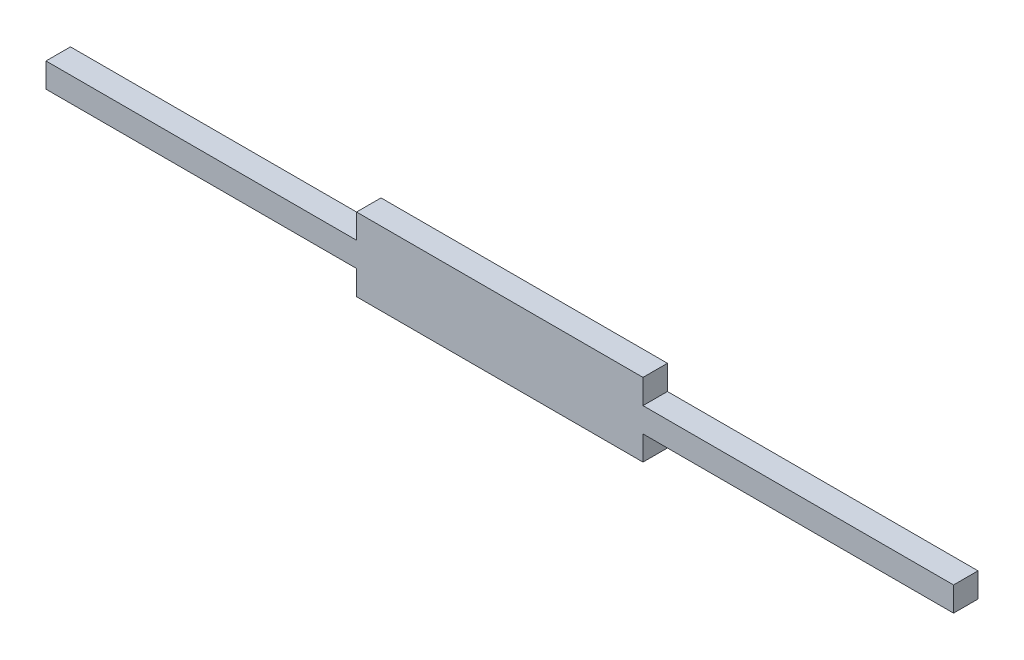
SolidWorks part; units mm, degrees
ref_plane "Front Plane" through (0, 0, 0) normal (0, 0, 1) x (1, 0, 0)
ref_plane "Top Plane" through (0, 0, 0) normal (0, 1, 0) x (1, 0, 0)
ref_plane "Right Plane" through (0, 0, 0) normal (1, 0, 0) x (0, 0, -1)
sketch "Sketch1" plane through (0, 0, 0) normal (0, 0, 1) x (1, 0, 0)
  line L0 (-38.059, -1.524) -> (-38.059, 0)
  line L1 (-38.059, 0) -> (-20.2135, 0)
  line L2 (-20.2135, 0) -> (-20.2135, -1.524)
  line L3 (-20.2135, -1.524) -> (-0.8668, -1.524)
  line L4 (-0.8668, -1.524) -> (-0.8668, -3.048)
  line L5 (-29.1362, 0) -> (-29.1362, 35.0525) construction
  line L6 (-57.4057, -1.524) -> (-57.4057, -3.048)
  line L7 (-38.059, -1.524) -> (-57.4057, -1.524)
  line L8 (-57.4057, -2.286) -> (-75.5602, -2.286) construction
  line L9 (-38.059, -3.048) -> (-57.4057, -3.048)
  line L10 (-20.2135, -3.048) -> (-0.8668, -3.048)
  line L11 (-20.2135, -4.572) -> (-20.2135, -3.048)
  line L12 (-38.059, -4.572) -> (-20.2135, -4.572)
  line L13 (-38.059, -3.048) -> (-38.059, -4.572)
extrude "Boss-Extrude1" add sketch "Sketch1" along normal blind 1.524
